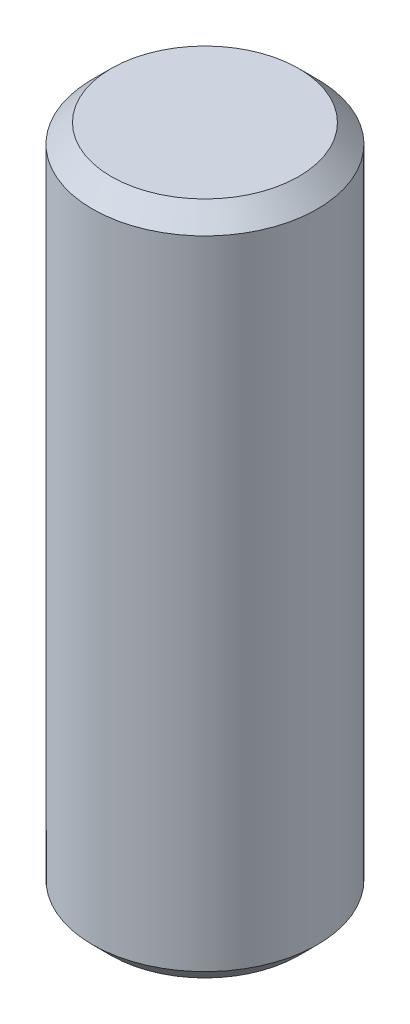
SolidWorks part; units mm, degrees
ref_plane "Спереди" through (0, 0, 0) normal (0, 0, 1) x (1, 0, 0)
ref_plane "Сверху" through (0, 0, 0) normal (0, 1, 0) x (1, 0, 0)
ref_plane "Справа" through (0, 0, 0) normal (1, 0, 0) x (0, 0, -1)
sketch "Эскиз1" plane through (0, 0, 0) normal (0, 1, 0) x (1, 0, 0)
  circle A0 centre (0, 0) radius 3
  dimension "D1" = 6
extrude "Бобышка-Вытянуть1" add sketch "Эскиз1" along normal blind 18
chamfer "Фаска1" distance 0.5 angle 45 2 edges at (0, 0, 3) (0, 18, 3)
